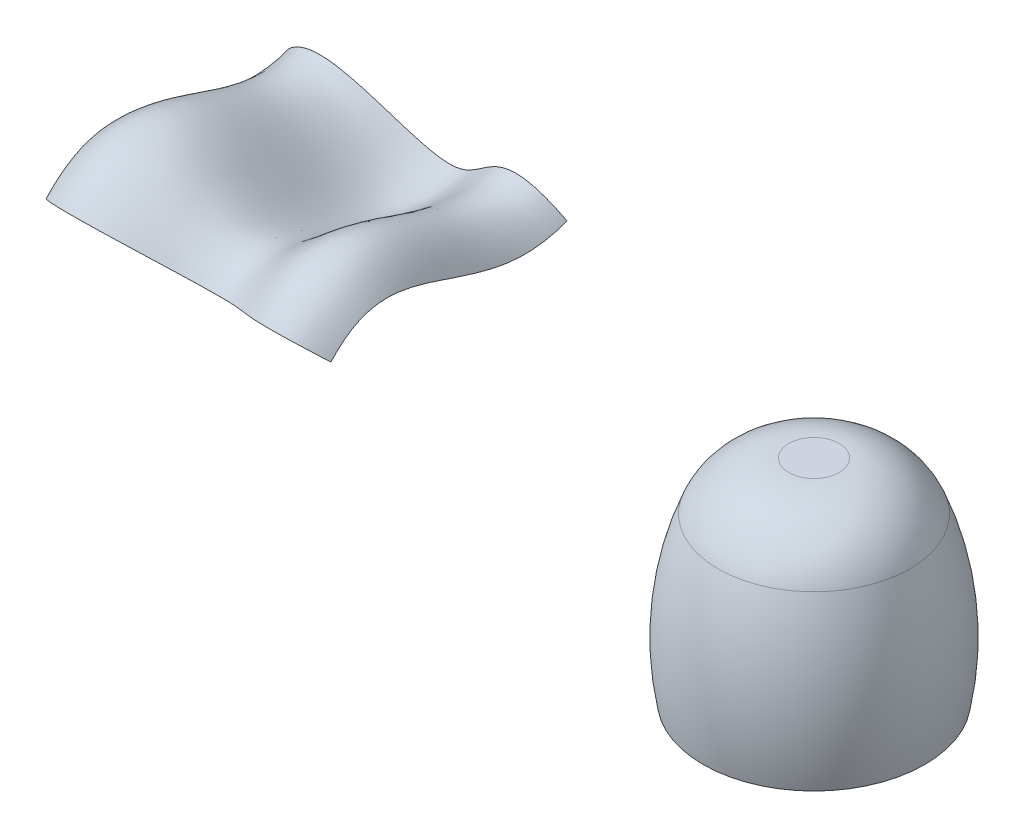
SolidWorks part; units mm, degrees
ref_plane "Front Plane" through (0, 0, 0) normal (0, 0, 1) x (1, 0, 0)
ref_plane "Top Plane" through (0, 0, 0) normal (0, 1, 0) x (1, 0, 0)
ref_plane "Right Plane" through (0, 0, 0) normal (1, 0, 0) x (0, 0, -1)
sketch "Sketch1" plane through (0, 0, 0) normal (1, 0, 0) x (0, 0, -1)
  spline S0 degree 3 poles (-81.7388, 22.5697) (-22.1774, 88.2281) (40.3018, 2.3227) (106.3418, 28.8729) knots 0 0 0 0 1 1 1 1
ref_plane "Plane1" through (0, 28.8729, -106.3418) normal (0, 0.373, -0.9278) x (-1, 0, 0)
sketch "Sketch2" plane through (0, 28.8729, -106.3418) normal (0, 0.373, -0.9278) x (-1, 0, 0)
  spline S0 degree 3 poles (-82.5623, -11.8776) (-44.4296, 42.01) (12.4672, -95.6347) (84.4595, 48.8531) (128.8868, 1.9451) knots 0 0 0 0 0.443178 1 1 1 1
surface "Surface-Sweep1"
sketch "Sketch3" plane through (0, 0, 0) normal (0, 0, 1) x (1, 0, 0)
  line L0 (385.524, 64.9627) -> (385.524, -98.5118)
  line L1 (385.524, 64.9627) -> (405.1122, 64.9627)
  line L2 (385.524, -98.5118) -> (471.7802, -98.5118)
  arc A0 (405.1122, 64.9627) -> (460.0961, 27.4884) centre (405.1122, 5.8882) cw
  arc A1 (460.0961, 27.4884) -> (471.7802, -98.5118) centre (248.3704, -55.6869) cw
revolve "Revolve1" add sketch "Sketch3" angle 360 about L0
ref_plane "Plane2" through (0, 0, 96.52) normal (0, 0, 1) x (1, 0, 0)
